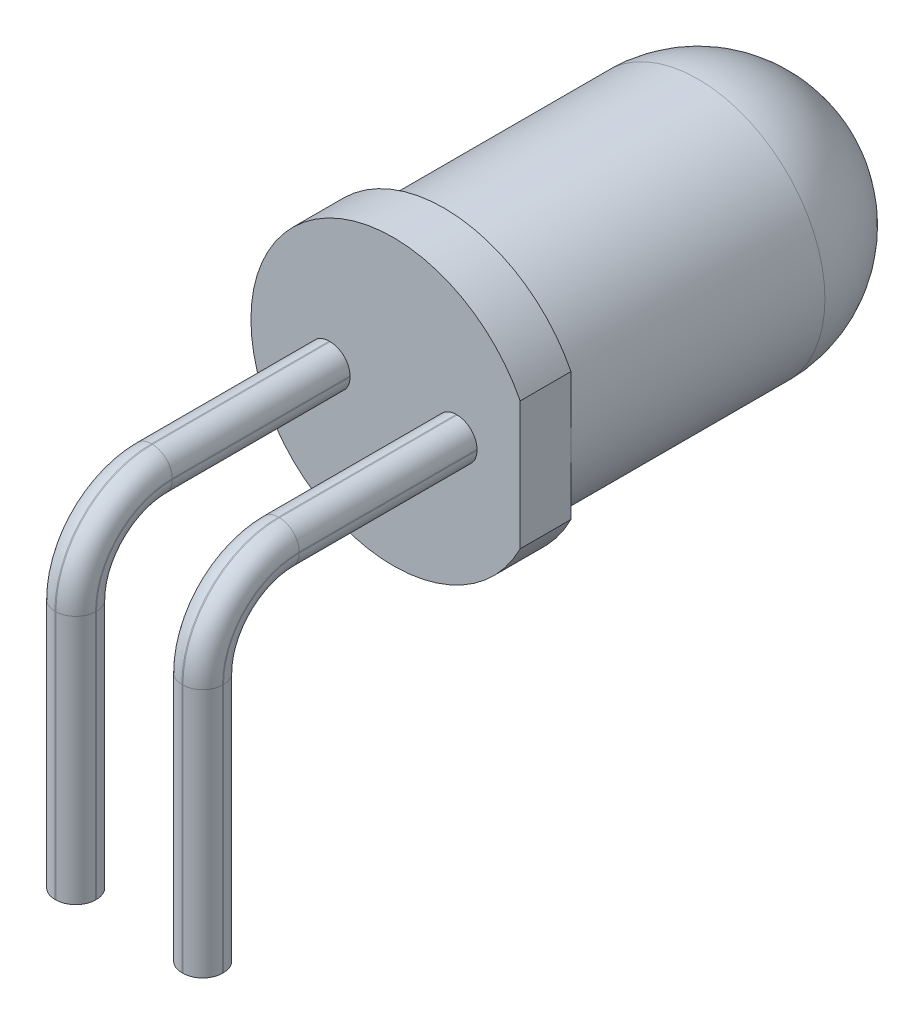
SolidWorks part; units mm, degrees
ref_plane "Face" through (0, 0, 0) normal (0, 0, 1) x (1, 0, 0)
ref_plane "Dessus" through (0, 0, 0) normal (0, 1, 0) x (1, 0, 0)
ref_plane "Droite" through (0, 0, 0) normal (1, 0, 0) x (0, 0, -1)
sketch "Esquisse1" plane through (0, 0, 0) normal (0, 0, 1) x (1, 0, 0)
  circle A0 centre (0, 0) radius 2.5
extrude "Base-Extrusion" add sketch "Esquisse1" along normal blind 8.5
sketch "Esquisse2" plane through (0, 0, 8.5) normal (0, 0, 1) x (1, 0, 0)
  line L0 (2.5, -2.4917) -> (2.5, 2.5621) construction
  line L1 (2.5, 1.261) -> (2.5, -1.261)
  arc A0 (2.5, 1.261) -> (2.5, -1.261) centre (0, 0) ccw
extrude "Boss.-Extru.1" add sketch "Esquisse2" against normal blind 1
fillet "Congé1" radius 2.5 1 edges at (2.5, 0, 0)
sketch "Esquisse4" plane through (0, 0, 0) normal (1, 0, 0) x (0, 0, -1)
  line L0 (1.383, 0) -> (-18.292, 0) construction
  line L1 (-8.5, 2.5234) -> (-8.5, -6.4179) construction
  line L2 (-12, 4.5057) -> (-12, -7.4301) construction
  line L3 (-13.5, 4.822) -> (-13.5, -7.8308) construction
  line L4 (-0.3251, -3) -> (-18.0389, -3) construction
  line L5 (-13.1, -1.5043) -> (-13.1, -6.4179)
  line L6 (-15.4873, -1.5) -> (-1.5, -1.5255) construction
  line L7 (-8.4545, -0.4) -> (-8.4545, 0.4)
  line L8 (-6, 4.1261) -> (-6, -7.641) construction
  line L9 (-13.1, -6.4179) -> (-13.9, -6.4179)
  line L10 (-8.4545, -0.4) -> (-12, -0.4)
  line L11 (-13.9, -6.4179) -> (-13.9, -1.5029)
  line L12 (-8.4545, 0.4) -> (-12, 0.4)
  arc A0 (-12, -0.4) -> (-13.1, -1.5043) centre (-12, -1.5) ccw
  arc A1 (-12, 0.4) -> (-13.9, -1.5029) centre (-12, -1.5) ccw
extrude "Boss.-Extru.2" add sketch "Esquisse4" along normal mid plane 3.3
sketch "Esquisse5" plane through (0, 0, 8.5) normal (0, 0, 1) x (1, 0, 0)
  line L0 (0, 2.2833) -> (0, -3.6189) construction
  line L1 (-0.85, 0.9378) -> (-0.85, -3.7624) construction
  line L2 (0.85, 0.8751) -> (0.85, -3.6906) construction
  line L4 (-0.85, 0.6239) -> (0.85, 0.6239)
  line L5 (-0.85, 0.6239) -> (-0.85, -8.5464)
  line L6 (-0.85, -8.5464) -> (0.85, -8.5464)
  line L7 (0.85, 0.6239) -> (0.85, -8.5464)
extrude "Enlèv. mat.-Extru.1" cut sketch "Esquisse5" along normal blind 10
fillet "Congé3" radius 0.39 24 edges at (-1.65, -0.7237, 12.7794) (-1.65, -0.4, 10.25) (-1.65, 0.4, 10.25) (-1.65, -0.1575, 13.3445) (-1.65, -3.9604, 13.9) (-1.65, -3.9611, 13.1) (1.65, -0.4, 10.25) (1.65, 0.4, 10.25) (1.65, -0.1575, 13.3445) (1.65, -3.9604, 13.9) (1.65, -3.9611, 13.1) (1.65, -0.7237, 12.7794) (0.85, -3.9611, 13.1) (-0.85, -3.9611, 13.1) (-0.85, -0.7237, 12.7794) (-0.85, -0.4, 10.25) (-0.85, 0.4, 10.25) (-0.85, -0.1575, 13.3445) (-0.85, -3.9604, 13.9) (0.85, -0.4, 10.25) (0.85, -0.7237, 12.7794) (0.85, -3.9604, 13.9) (0.85, -0.1575, 13.3445) (0.85, 0.4, 10.25)
